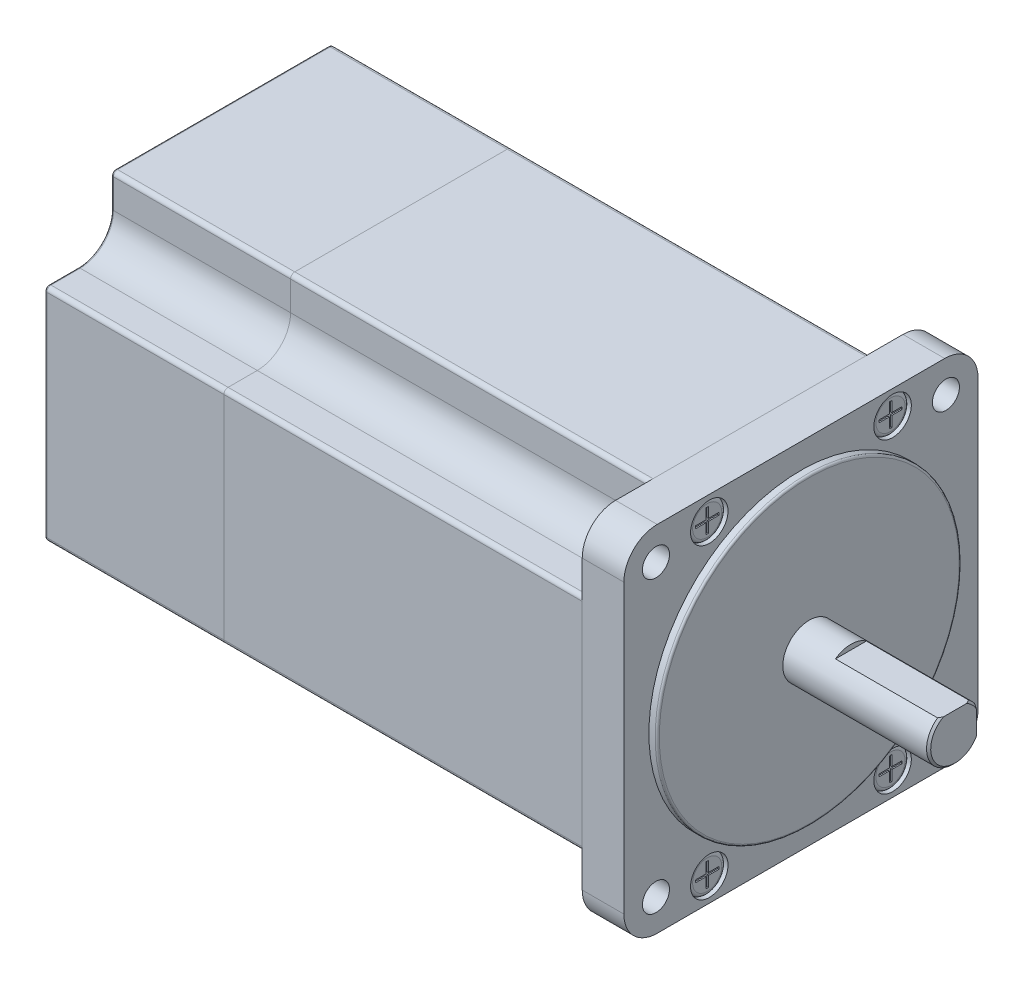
SolidWorks part; units mm, degrees
ref_plane "前视基准面" through (0, 0, 0) normal (0, 0, 1) x (1, 0, 0)
ref_plane "上视基准面" through (0, 0, 0) normal (0, 1, 0) x (1, 0, 0)
ref_plane "右视基准面" through (0, 0, 0) normal (1, 0, 0) x (0, 0, -1)
sketch "草图1" plane through (0, 0, 0) normal (1, 0, 0) x (0, 0, -1)
  line L2 (42.5, 34.5) -> (42.5, -34.5)
  line L3 (34.5, -42.5) -> (-34.5, -42.5)
  line L4 (-42.5, -34.5) -> (-42.5, 34.5)
  line L5 (-34.5, 42.5) -> (34.5, 42.5)
  arc A0 (-42.5, -34.5) -> (-34.5, -42.5) centre (-34.5, -34.5) ccw
  arc A1 (34.5, -42.5) -> (42.5, -34.5) centre (34.5, -34.5) ccw
  arc A2 (42.5, 34.5) -> (34.5, 42.5) centre (34.5, 34.5) ccw
  arc A3 (-42.5, 34.5) -> (-34.5, 42.5) centre (-34.5, 34.5) cw
  dimension "D1" = 8
extrude "凸台-拉伸1" add sketch "草图1" against normal blind 10
sketch "草图2" plane through (-10, 0, 0) normal (-1, 0, 0) x (0, 0, 1)
  line L0 (26.5, -34.5) -> (26.5, -41.5)
  line L1 (34.5, -42.5) -> (-34.5, -42.5) construction
  line L2 (-26.5, -42.5) -> (25.5, -42.5)
  line L3 (42.5, -25.5) -> (42.5, 25.5)
  line L4 (25.5, 42.5) -> (-25.5, 42.5)
  line L5 (42.5, 34.5) -> (42.5, -34.5) construction
  line L6 (41.5, -26.5) -> (34.5, -26.5)
  line L7 (-42.5, 25.5) -> (-42.5, -25.5)
  line L8 (34.5, 26.5) -> (41.5, 26.5)
  line L12 (-34.5, 42.5) -> (34.5, 42.5) construction
  line L13 (26.5, 41.5) -> (26.5, 34.5)
  line L15 (-26.5, 34.5) -> (-26.5, 41.5)
  line L19 (-42.5, -34.5) -> (-42.5, 34.5) construction
  line L20 (-41.5, 26.5) -> (-34.5, 26.5)
  line L22 (-34.5, -26.5) -> (-41.5, -26.5)
  line L26 (-26.5, -42.5) -> (-26.5, -34.5)
  arc A0 (25.5, -42.5) -> (26.5, -41.5) centre (25.5, -41.5) ccw
  arc A1 (-34.5, 26.5) -> (-26.5, 34.5) centre (-34.5, 34.5) ccw
  arc A2 (26.5, 34.5) -> (34.5, 26.5) centre (34.5, 34.5) ccw
  arc A3 (34.5, -26.5) -> (26.5, -34.5) centre (34.5, -34.5) ccw
  arc A4 (-26.5, -34.5) -> (-34.5, -26.5) centre (-34.5, -34.5) ccw
  arc A5 (41.5, -26.5) -> (42.5, -25.5) centre (41.5, -25.5) ccw
  arc A6 (42.5, 25.5) -> (41.5, 26.5) centre (41.5, 25.5) ccw
  arc A7 (25.5, 42.5) -> (26.5, 41.5) centre (25.5, 41.5) cw
  arc A8 (-25.5, 42.5) -> (-26.5, 41.5) centre (-25.5, 41.5) ccw
  arc A9 (-41.5, 26.5) -> (-42.5, 25.5) centre (-41.5, 25.5) ccw
  arc A10 (-42.5, -25.5) -> (-41.5, -26.5) centre (-41.5, -25.5) ccw
  point P7 (26.5, -42.5)
  point P17 (42.5, -26.5)
  point P34 (42.5, 26.5)
  point P45 (26.5, 42.5)
  point P51 (-26.5, 42.5)
  point P54 (-42.5, 26.5)
  point P57 (-42.5, -26.5)
  dimension "D1" = 1
extrude "凸台-拉伸2" add sketch "草图2" along normal blind 86 separate body
sketch "草图3" plane through (-96, 0, 0) normal (-1, 0, 0) x (0, 0, 1)
  line L0 (-26.5, -42.5) -> (-26.5, -41.5)
  line L1 (-26.5, -34.5) -> (-26.5, -42.5) construction
  line L3 (-26.5, -42.5) -> (-25.5, -42.5)
  arc A0 (-26.5, -41.5) -> (-25.5, -42.5) centre (-25.5, -41.5) ccw
extrude "切除-拉伸1" cut sketch "草图3" against normal blind 86
sketch "草图4" plane through (0, 0, 0) normal (1, 0, 0) x (0, 0, -1)
  circle A0 centre (0, 0) radius 36.5
extrude "凸台-拉伸3" add sketch "草图4" along normal blind 2
sketch "草图5" plane through (2, 0, 0) normal (1, 0, 0) x (0, 0, -1)
  circle A0 centre (0, 0) radius 6.35
extrude "凸台-拉伸4" add sketch "草图5" along normal blind 35
chamfer "倒角1" distance 0.5 angle 45 1 edges at (37, 0, -6.35)
sketch "草图6" plane through (37, 0, 0) normal (1, 0, 0) x (0, 0, -1)
  line L2 (3.7148, 5.15) -> (-3.7148, 5.15)
  line L3 (5.15, 3.7148) -> (5.15, -3.7148)
  arc A0 (5.15, -3.7148) -> (-3.7148, 5.15) centre (0, 0) ccw
extrude "切除-拉伸2" cut sketch "草图6" against normal blind 25 contours L3 M1 | L3 A0 M1 | L2 A0 M1 | L2 M1
sketch "草图8" plane through (0, 0, 0) normal (1, 0, 0) x (0, 0, -1)
  circle A0 centre (-34.8, 34.8) radius 3.25
  circle A1 centre (34.8, 34.8) radius 3.25
  circle A2 centre (34.8, -34.8) radius 3.25
  circle A3 centre (-34.8, -34.8) radius 3.25
extrude "切除-拉伸3" cut sketch "草图8" against normal blind 10
sketch "草图9" plane through (0, 0, 0) normal (1, 0, 0) x (0, 0, -1)
  circle A0 centre (22, -36.8) radius 4.5
  circle A1 centre (-22, -36.8) radius 4.5
  circle A2 centre (22, 36.8) radius 4.5
  circle A3 centre (-22, 36.8) radius 4.5
extrude "切除-拉伸5" cut sketch "草图9" against normal blind 1.5
sketch "草图13" plane through (-1.5, 0, 0) normal (1, 0, 0) x (0, 0, -1)
  circle A0 centre (-22, -36.8) radius 4.5
  circle A1 centre (22, 36.8) radius 4.5
  circle A2 centre (-22, 36.8) radius 4.5
  circle A3 centre (22, -36.8) radius 4.5
extrude "凸台-拉伸6" add sketch "草图13" along normal blind 1 separate body
fillet "圆角2" radius 1 1 edges at (-0.5, -36.8, -26.5)
fillet "圆角3" radius 1 1 edges at (-0.5, -36.8, 17.5)
fillet "圆角4" radius 1 1 edges at (-0.5, 36.8, 17.5)
fillet "圆角5" radius 1 1 edges at (-0.5, 36.8, -26.5)
sketch "草图14" plane through (-0.5, 0, 0) normal (1, 0, 0) x (0, 0, -1)
  line L0 (21.7, 36.5) -> (21.7, 33.9975)
  line L1 (22.3, 36.5) -> (24.7962, 36.5)
  line L4 (-22.3, 37.1) -> (-24.8, 37.1)
  line L5 (-24.8, 37.1) -> (-24.8, 36.5)
  line L6 (-24.8, 36.5) -> (-22.3, 36.5)
  line L7 (-19.2, 36.5) -> (-19.2, 37.1)
  line L8 (-19.2, 37.1) -> (-21.7, 37.1)
  line L10 (-21.7, 39.5968) -> (-22.3, 39.5968)
  line L11 (-22.3, 39.5968) -> (-22.3, 37.1)
  line L12 (-22.3, 33.9975) -> (-21.7, 33.9975)
  line L13 (-21.7, 33.9975) -> (-21.7, 36.5)
  line L18 (21.7, 37.1) -> (19.1955, 37.1)
  line L19 (19.1955, 37.1) -> (19.1955, 36.5)
  line L20 (19.1955, 36.5) -> (21.7, 36.5)
  line L21 (24.7962, 36.5) -> (24.7962, 37.1)
  line L22 (24.7962, 37.1) -> (22.3, 37.1)
  line L23 (22.3, 37.1) -> (22.3, 39.5968)
  line L24 (22.3, 39.5968) -> (21.7, 39.5968)
  line L25 (21.7, 39.5968) -> (21.7, 37.1)
  line L26 (21.7, 33.9975) -> (22.3, 33.9975)
  line L27 (22.3, 33.9975) -> (22.3, 36.5)
  line L28 (-21.7, 37.1) -> (-21.7, 39.5968)
  line L29 (-22.3, 36.5) -> (-22.3, 33.9975)
  line L30 (-21.7, 36.5) -> (-19.2, 36.5)
  line L32 (21.7, -36.5) -> (21.7, -34.0041)
  line L33 (21.7, -34.0041) -> (22.3, -34.0041)
  line L34 (22.3, -34.0041) -> (22.3, -36.5)
  line L35 (22.3, -39.6066) -> (21.7, -39.6066)
  line L36 (21.7, -39.6066) -> (21.7, -37.1)
  line L37 (21.7, -37.1) -> (19.1955, -37.1)
  line L38 (19.1955, -37.1) -> (19.1955, -36.5)
  line L39 (19.1955, -36.5) -> (21.7, -36.5)
  line L40 (24.7962, -36.5) -> (24.7962, -37.1)
  line L41 (24.7962, -37.1) -> (22.3, -37.1)
  line L42 (22.3, -37.1) -> (22.3, -39.6066)
  line L43 (22.3, -36.5) -> (24.7962, -36.5)
  line L47 (-21.7, -37.1) -> (-19.2, -37.1)
  line L48 (-19.2, -37.1) -> (-19.2, -36.5)
  line L49 (-19.2, -36.5) -> (-21.7, -36.5)
  line L50 (-24.8, -36.5) -> (-24.8, -37.1)
  line L51 (-24.8, -37.1) -> (-22.3, -37.1)
  line L52 (-22.3, -37.1) -> (-22.3, -39.6066)
  line L53 (-22.3, -39.6066) -> (-21.7, -39.6066)
  line L54 (-21.7, -39.6066) -> (-21.7, -37.1)
  line L55 (-21.7, -34.0041) -> (-22.3, -34.0041)
  line L56 (-22.3, -34.0041) -> (-22.3, -36.5)
  line L58 (-21.7, -36.5) -> (-21.7, -34.0041)
  line L59 (-22.3, -36.5) -> (-24.8, -36.5)
extrude "切除-拉伸6" cut sketch "草图14" against normal blind 0.3
sketch "草图15" plane through (-96, 0, 0) normal (-1, 0, 0) x (0, 0, 1)
  line L1 (-25.5, -42.5) -> (25.5, -42.5)
  line L2 (-42.5, -25.5) -> (-42.5, 25.5)
  line L3 (-26.5, -34.5) -> (-26.5, -41.5)
  line L4 (42.5, -25.5) -> (42.5, 25.5)
  line L5 (-41.5, -26.5) -> (-34.5, -26.5)
  line L9 (26.5, -41.5) -> (26.5, -34.5)
  line L11 (34.5, -26.5) -> (41.5, -26.5)
  line L13 (41.5, 26.5) -> (34.5, 26.5)
  line L15 (26.5, 34.5) -> (26.5, 41.5)
  line L16 (-26.5, 41.5) -> (-26.5, 34.5)
  line L18 (-34.5, 26.5) -> (-41.5, 26.5)
  line L19 (-25.5, 42.5) -> (25.5, 42.5)
  arc A0 (-34.5, 26.5) -> (-26.5, 34.5) centre (-34.5, 34.5) ccw
  arc A1 (-26.5, -41.5) -> (-25.5, -42.5) centre (-25.5, -41.5) ccw
  arc A2 (34.5, -26.5) -> (26.5, -34.5) centre (34.5, -34.5) ccw
  arc A3 (-26.5, -34.5) -> (-34.5, -26.5) centre (-34.5, -34.5) ccw
  arc A4 (-41.5, 26.5) -> (-42.5, 25.5) centre (-41.5, 25.5) ccw
  arc A5 (-25.5, 42.5) -> (-26.5, 41.5) centre (-25.5, 41.5) ccw
  arc A6 (26.5, 41.5) -> (25.5, 42.5) centre (25.5, 41.5) ccw
  arc A7 (42.5, 25.5) -> (41.5, 26.5) centre (41.5, 25.5) ccw
  arc A8 (41.5, -26.5) -> (42.5, -25.5) centre (41.5, -25.5) ccw
  arc A9 (25.5, -42.5) -> (26.5, -41.5) centre (25.5, -41.5) ccw
  arc A11 (-42.5, -25.5) -> (-41.5, -26.5) centre (-41.5, -25.5) ccw
  arc A12 (26.5, 34.5) -> (34.5, 26.5) centre (34.5, 34.5) ccw
  point P0 (0, 0)
extrude "凸台-拉伸7" add sketch "草图15" along normal blind 43 separate body
fillet "圆角6" radius 0.5 24 edges at (-139, 26.5, -38) (-139, 28.8431, -28.8431) (-139, 38, -26.5) (-139, 42.2071, -26.2071) (-139, 42.5, 0) (-139, 42.2071, 26.2071) (-139, 38, 26.5) (-139, 28.8431, 28.8431) (-139, 26.5, 38) (-139, 26.2071, 42.2071) (-139, 0, 42.5) (-139, -26.2071, 42.2071) (-139, -26.5, 38) (-139, -28.8431, 28.8431) (-139, -38, 26.5) (-139, -42.2071, 26.2071) (-139, -42.5, 0) (-139, -42.2071, -26.2071) (-139, -38, -26.5) (-139, -28.8431, -28.8431) (-139, -26.5, -38) (-139, -26.2071, -42.2071) (-139, 0, -42.5) (-139, 26.2071, -42.2071)
fillet "圆角7" radius 0.5 1 edges at (2, 0, -36.5)
